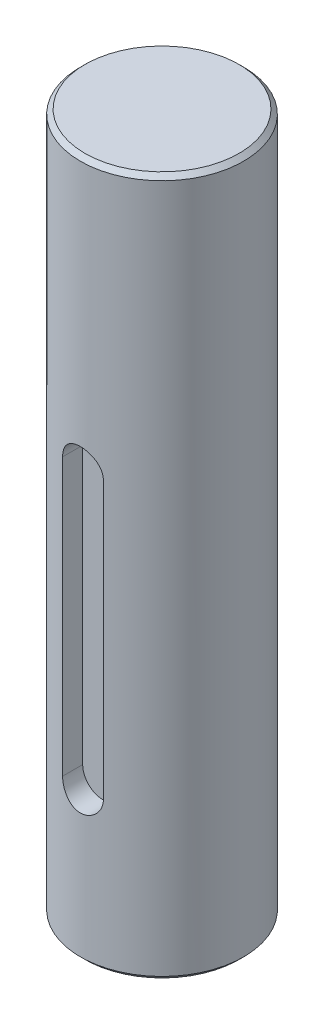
SolidWorks part; units mm, degrees
ref_plane "Plan de face" through (0, 0, 0) normal (0, 0, 1) x (1, 0, 0)
ref_plane "Plan de dessus" through (0, 0, 0) normal (0, 1, 0) x (1, 0, 0)
ref_plane "Plan de droite" through (0, 0, 0) normal (1, 0, 0) x (0, 0, -1)
sketch "Esquisse1" plane through (0, 0, 0) normal (0, 0, 1) x (1, 0, 0)
  line L0 (18, 154) -> (0, 154)
  line L1 (0, 154) -> (0, 0)
  line L2 (0, 0) -> (18, 0)
  line L3 (18, 0) -> (18, 154)
  line L4 (0, 154) -> (0, 0) construction
revolve "Révolution1" add sketch "Esquisse1" angle 360 about L4
ref_plane "Plan4" through (0, 0, 13) normal (0, 0, -1) x (-1, 0, 0)
sketch "Esquisse2" plane through (0, 0, 13) normal (0, 0, -1) x (-1, 0, 0)
  line L0 (-4.5, 94) -> (-4.5, 33)
  line L1 (4.5, 33) -> (4.5, 94)
  arc A0 (4.5, 94) -> (-4.5, 94) centre (0, 94) ccw
  arc A1 (-4.5, 33) -> (4.5, 33) centre (0, 33) ccw
extrude "Enlèv. mat.-Extru.1" cut sketch "Esquisse2" against normal up to next
chamfer "Chanfrein1" distance 1 angle 45 1 edges at (0, 154, -18)
chamfer "Chanfrein2" distance 1 angle 45 1 edges at (0, 0, -18)
